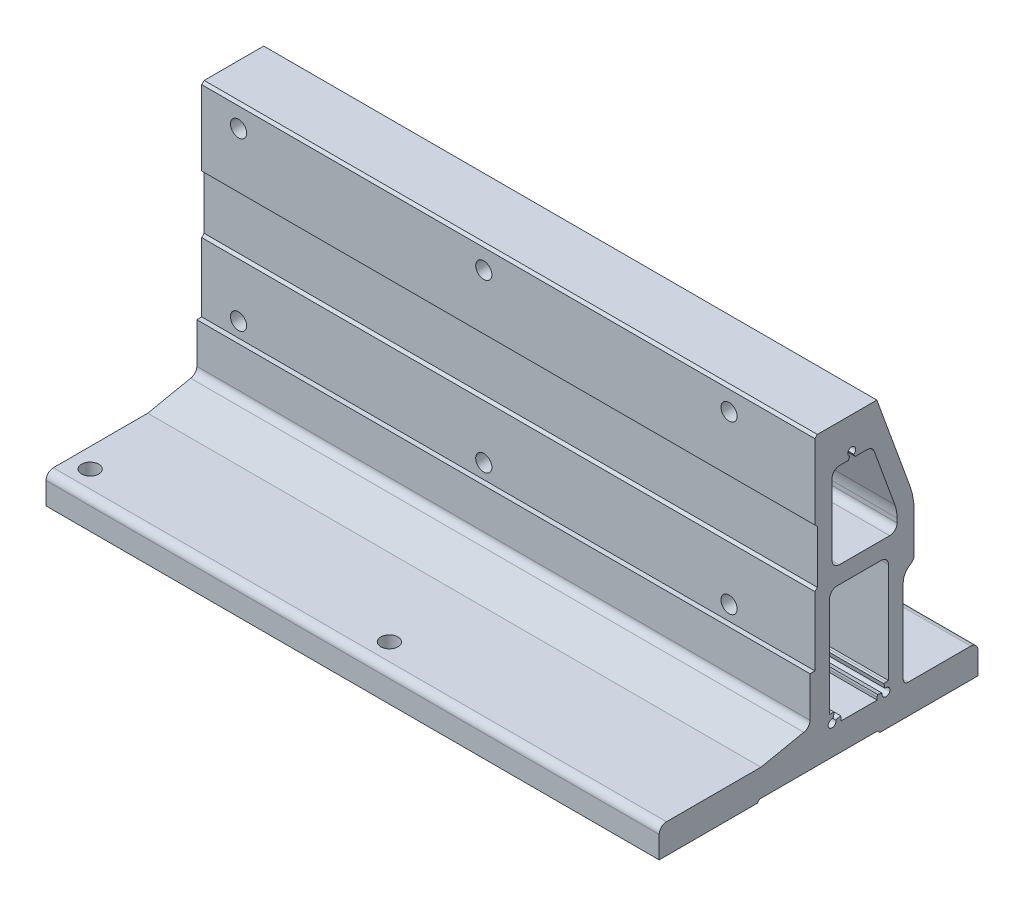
SolidWorks part; units mm, degrees
ref_plane "정면" through (0, 0, 0) normal (0, 0, 1) x (1, 0, 0)
ref_plane "윗면" through (0, 0, 0) normal (0, 1, 0) x (1, 0, 0)
ref_plane "우측면" through (0, 0, 0) normal (1, 0, 0) x (0, 0, -1)
sketch "스케치1" plane through (0, 0, 0) normal (1, 0, 0) x (0, 0, -1)
  line L0 (-1.5, 116) -> (-0.5, 117)
  line L1 (-0.5, 117) -> (23.7537, 117)
  line L2 (23.7537, 117) -> (37.1908, 80.0819)
  line L3 (39, 69.8213) -> (39, 54.7942)
  line L4 (34.5, 47) -> (34.5, 13)
  line L5 (36.5, 11) -> (62, 11)
  line L6 (65, 8) -> (65, -1)
  line L7 (65, -1) -> (25, -1)
  line L8 (25, -1) -> (24, 0)
  line L9 (24, 0) -> (-24, 0)
  line L10 (-24, 0) -> (-25, -1)
  line L11 (-25, -1) -> (-65, -1)
  line L12 (-65, -1) -> (-65, 8)
  line L13 (-62, 11) -> (-23.5, 11)
  line L14 (-23.5, 11) -> (-6.0351, 14.6023)
  line L15 (-3.5, 17.5661) -> (-3.5, 34)
  line L16 (-3.5, 34) -> (-1.5, 34)
  line L17 (-1.5, 34) -> (-1.5, 62)
  line L18 (-1.5, 62) -> (-0.5, 63)
  line L19 (-0.5, 63) -> (-0.5, 84.5)
  line L20 (-0.5, 84.5) -> (-1.5, 85.5)
  line L21 (-1.5, 85.5) -> (-1.5, 116)
  line L22 (22.6644, 99.5261) -> (31.0954, 76.3622)
  line L23 (32, 71.2319) -> (32, 69.5)
  line L24 (29, 66.5) -> (8.5, 66.5)
  line L25 (5.5, 69.5) -> (5.5, 98.5)
  line L26 (8.5, 101.5) -> (12.0566, 101.5)
  line L27 (12.0566, 101.5) -> (12.7, 102.6144)
  line L28 (14.3, 102.6144) -> (14.9434, 101.5)
  line L29 (14.9434, 101.5) -> (19.8454, 101.5)
  line L30 (28.5, 15.6) -> (28.5, 56.5)
  line L31 (25.5, 59.5) -> (7.5, 59.5)
  line L32 (4.5, 56.5) -> (4.5, 15.6)
  line L33 (4.5, 15.6) -> (5.5, 15.6)
  line L34 (6.4317, 15.4773) -> (5.9141, 13.5455)
  line L35 (7.0455, 12.4141) -> (8.9773, 12.9317)
  line L36 (9.1, 12) -> (9.1, 11)
  line L37 (9.1, 11) -> (23.9, 11)
  line L38 (23.9, 11) -> (23.9, 12)
  line L39 (24.0227, 12.9317) -> (25.9545, 12.4141)
  line L40 (27.0859, 13.5455) -> (26.5683, 15.4773)
  line L41 (27.5, 15.6) -> (28.5, 15.6)
  arc A0 (39, 69.8213) -> (37.1908, 80.0819) centre (9, 69.8213) ccw
  arc A1 (37.5, 52.1962) -> (39, 54.7942) centre (36, 54.7942) ccw
  arc A2 (37.5, 52.1962) -> (34.5, 47) centre (40.5, 47) ccw
  arc A3 (34.5, 13) -> (36.5, 11) centre (36.5, 13) ccw
  arc A4 (65, 8) -> (62, 11) centre (62, 8) ccw
  arc A5 (-62, 11) -> (-65, 8) centre (-62, 8) ccw
  arc A6 (-6.0351, 14.6023) -> (-3.5, 17.5661) centre (-6.5, 17.5661) ccw
  arc A7 (32, 71.2319) -> (31.0954, 76.3622) centre (17, 71.2319) ccw
  arc A8 (29, 66.5) -> (32, 69.5) centre (29, 69.5) ccw
  arc A9 (5.5, 69.5) -> (8.5, 66.5) centre (8.5, 69.5) ccw
  arc A10 (8.5, 101.5) -> (5.5, 98.5) centre (8.5, 98.5) ccw
  arc A11 (14.3, 102.6144) -> (12.7, 102.6144) centre (13.5, 104) ccw
  arc A12 (22.6644, 99.5261) -> (19.8454, 101.5) centre (19.8454, 98.5) ccw
  arc A13 (28.5, 56.5) -> (25.5, 59.5) centre (25.5, 56.5) ccw
  arc A14 (7.5, 59.5) -> (4.5, 56.5) centre (7.5, 56.5) ccw
  arc A15 (6.4317, 15.4773) -> (5.5, 15.6) centre (5.5, 12) ccw
  arc A16 (5.9141, 13.5455) -> (7.0455, 12.4141) centre (5.5, 12) ccw
  arc A17 (9.1, 12) -> (8.9773, 12.9317) centre (5.5, 12) ccw
  arc A18 (24.0227, 12.9317) -> (23.9, 12) centre (27.5, 12) ccw
  arc A19 (25.9545, 12.4141) -> (27.0859, 13.5455) centre (27.5, 12) ccw
  arc A20 (27.5, 15.6) -> (26.5683, 15.4773) centre (27.5, 12) ccw
extrude "보스-돌출1" add sketch "스케치1" along normal mid plane 250
hole_wizard "M6 소켓 머리 캡 나사용 카운터보어1" positions "스케치2" profile "스케치3" counterbore size "M6" standard "KS"
sketch "스케치2" plane through (0, 0, -39) normal (0, 0, -1) x (-1, 0, 0)
  line L0 (-125, -1) -> (125, -1) construction
  line L1 (-125, 80.0819) -> (-125, 117) construction
  point P0 (-90, 108)
  point P6 (-90, 40)
  dimension "D1" = 68
  dimension "D2" = 41
  dimension "D3" = 35
sketch "스케치3" plane through (90, 108, -39) normal (1, 0, 0) x (0, 1, 0)
  line L0 (0, 0) -> (0, 104)
  line L1 (0, 104) -> (3.3, 104)
  line L3 (3.3, 104) -> (3.3, 34.5)
  line L4 (3.3, 34.5) -> (5.5, 34.5)
  line L5 (5.5, 34.5) -> (5.5, 0)
  line L7 (5.5, 0) -> (0, 0)
  line L11 (0, -6.35) -> (0, 107.95) construction
  dimension "관통 구멍 지름" = 6.6
  dimension "관통 구멍 깊이" = 104
  dimension "카운터보어 지름" = 11
  dimension "카운터보어 깊이" = 34.5
pattern_linear "선형 패턴1" count 3 spacing 100 along (-1, 0, 0) of "M6 소켓 머리 캡 나사용 카운터보어1"
hole_wizard "M4 나사 구멍1" positions "스케치4" profile "스케치5" tap size "M4" standard "ISO"
sketch "스케치4" plane through (-125, 0, 0) normal (-1, 0, 0) x (0, 0, 1)
  line L0 (-65, -1) -> (-65, 8) construction
  line L1 (-25, -1) -> (-65, -1) construction
  point P0 (-37, 5)
  point P3 (-9, 5)
  dimension "D1" = 28
  dimension "D2" = 28
  dimension "D3" = 6
sketch "스케치5" plane through (-125, 5, -37) normal (0, 1, 0) x (0, 0, 1)
  line L0 (0, 0) -> (0, 10.9914)
  line L1 (0, 10.9914) -> (1.65, 10)
  line L2 (1.65, 10) -> (1.65, 0.375)
  line L3 (1.65, 0.375) -> (2.025, 0)
  line L5 (2.025, 0) -> (0, 0)
  line L6 (-1.65, 0.375) -> (-2.025, 0) construction
  line L10 (0, 10.9914) -> (-1.65, 10) construction
  line L11 (0, -6.35) -> (0, 107.95) construction
  dimension "탭 드릴 지름" = 3.3
  dimension "탭 드릴 깊이" = 10
  dimension "표면 카운터싱크 지름" = 4.05
  dimension "표면 카운터싱크 각도" = 90
  dimension "드릴 각도" = 118
hole_wizard "Ø5.0mm 맞춤핀 구멍1" positions "스케치6" profile "스케치7" hole size "Ø5.0" standard "ISO"
sketch "스케치6" plane through (0, 0, 0) normal (0, -1, 0) x (-1, 0, 0)
  line L0 (0, 0) -> (138.4724, 0) construction
  line L1 (125, -24) -> (125, 24) construction
  point P5 (117, 0)
  point P7 (-5, 0)
  dimension "D1" = 8
  dimension "D2" = 122
sketch "스케치7" plane through (5, 0, 0) normal (1, 0, 0) x (0, 0, -1)
  line L0 (0, 0) -> (0, 11.5022)
  line L1 (0, 11.5022) -> (2.5, 10)
  line L2 (2.5, 10) -> (2.5, 0)
  line L5 (2.5, 0) -> (0, 0)
  line L10 (0, 11.5022) -> (-2.5, 10) construction
  line L11 (0, -6.35) -> (0, 107.95) construction
  dimension "구멍 지름" = 5
  dimension "구멍 깊이" = 10
  dimension "드릴 각도" = 118
hole_wizard "Ø7.0 (7) 지름 구멍1" positions "스케치8" profile "스케치9" hole size "Ø7.0" standard "ISO"
sketch "스케치8" plane through (0, -1, 0) normal (0, -1, 0) x (-1, 0, 0)
  line L0 (-125, 65) -> (125, 65) construction
  line L1 (125, -65) -> (125, -25) construction
  point P0 (117, -55)
  point P2 (-5, -55)
  point P4 (117, 55)
  point P6 (-5, 55)
  dimension "D1" = 10
  dimension "D2" = 110
  dimension "D3" = 8
  dimension "D4" = 122
sketch "스케치9" plane through (-117, -1, 55) normal (1, 0, 0) x (0, 0, -1)
  line L0 (0, 0) -> (0, 118)
  line L1 (0, 118) -> (3.5, 118)
  line L2 (3.5, 118) -> (3.5, 0)
  line L5 (3.5, 0) -> (0, 0)
  line L11 (0, -6.35) -> (0, 107.95) construction
  dimension "관통 구멍 지름" = 7
  dimension "관통 구멍 깊이" = 118
